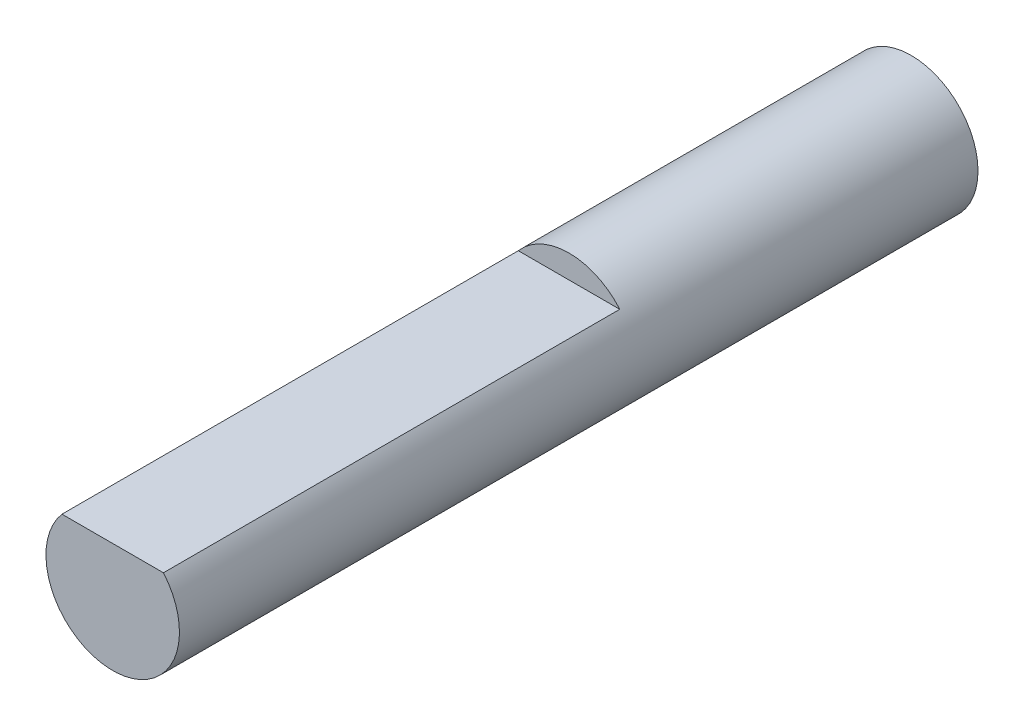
SolidWorks part; units mm, degrees
ref_plane "Front Plane" through (0, 0, 0) normal (0, 0, 1) x (1, 0, 0)
ref_plane "Top Plane" through (0, 0, 0) normal (0, 1, 0) x (1, 0, 0)
ref_plane "Right Plane" through (0, 0, 0) normal (1, 0, 0) x (0, 0, -1)
sketch "Sketch1" plane through (0, 0, 0) normal (0, 0, 1) x (1, 0, 0)
  circle A0 centre (0, 0) radius 1.4859
  dimension "D1" = 2.9718
extrude "Boss-Extrude1" add sketch "Sketch1" along normal blind 17.78
sketch "Sketch2" plane through (0, 0, 17.78) normal (0, 0, 1) x (1, 0, 0)
  line L0 (-1.3765, -1.4859) -> (1.6853, -1.4859) construction
  line L1 (-1.5637, 1.8547) -> (2.0036, 1.8547)
  line L2 (-1.5637, 1.8547) -> (-1.5637, 0.9652)
  line L3 (-1.5637, 0.9652) -> (2.0036, 0.9652)
  line L4 (2.0036, 1.8547) -> (2.0036, 0.9652)
  dimension "D1" = 2.4511
extrude "Cut-Extrude1" cut sketch "Sketch2" against normal blind 10.16
